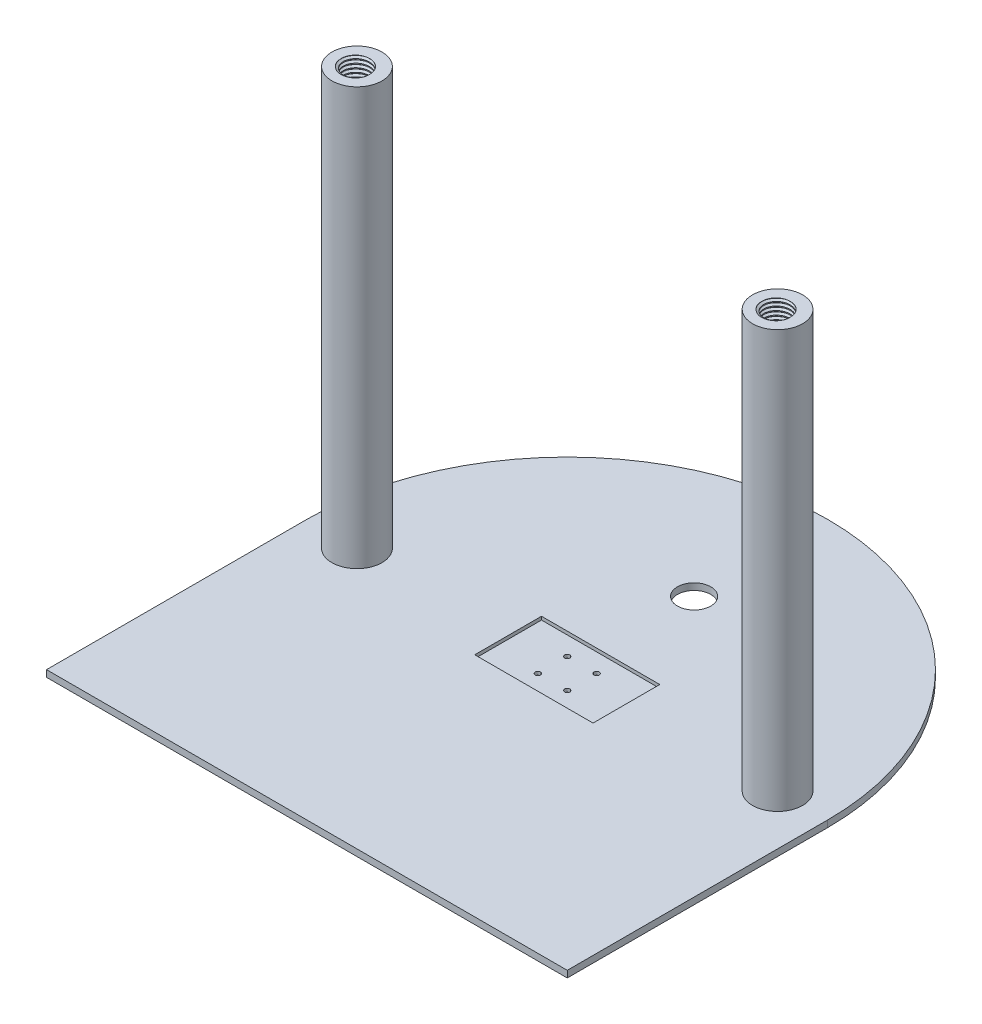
SolidWorks part; units mm, degrees
ref_plane "Front Plane" through (0, 0, 0) normal (0, 0, 1) x (1, 0, 0)
ref_plane "Top Plane" through (0, 0, 0) normal (0, 1, 0) x (1, 0, 0)
ref_plane "Right Plane" through (0, 0, 0) normal (1, 0, 0) x (0, 0, -1)
sketch "Sketch1" plane through (0, 0, 0) normal (0, 1, 0) x (1, 0, 0)
  line L1 (-99.06, 0) -> (99.06, 0)
  line L2 (-99.06, 0) -> (-99.06, -99.06)
  line L3 (-99.06, -99.06) -> (99.06, -99.06)
  line L4 (99.06, 0) -> (99.06, -99.06)
  circle A0 centre (0, 0) radius 99.06
  dimension "D1" = 198.12
extrude "Boss-Extrude1" add sketch "Sketch1" along normal blind 2.54 contours L1 A0 | A0 L1 | A0 L2 L3 | A0 L3 L4
sketch "Sketch2" plane through (0, 2.54, 0) normal (0, 1, 0) x (1, 0, 0)
  line L0 (0, -99.06) -> (0, 99.06) construction
  line L1 (-99.06, -99.06) -> (99.06, -99.06) construction
  line L2 (0, 0) -> (-38.4948, -22.225) construction
  line L3 (0, 0) -> (38.4948, -22.225) construction
  line L4 (0, 0) -> (-80.01, 0) construction
  line L5 (0, 0) -> (80.01, 0) construction
  line L6 (-99.06, 0) -> (-99.06, -99.06) construction
  arc A0 (99.06, 0) -> (-99.06, 0) centre (0, 0) ccw construction
  circle A5 centre (-80.01, 0) radius 6.35
  circle A6 centre (80.01, 0) radius 6.35
  dimension "D7" = 12.7
  dimension "D2" = 120
  dimension "D3" = 120
  dimension "D4" = 44.45
  dimension "D6" = 19.05
extrude "Cut-Extrude1" cut sketch "Sketch2" against normal through all
sketch "Sketch3" plane through (0, 2.54, 0) normal (0, 1, 0) x (1, 0, 0)
  circle A0 centre (-80.01, 0) radius 9.525
  circle A1 centre (80.01, 0) radius 9.525
  circle A2 centre (-80.01, 0) radius 6.35
  circle A3 centre (80.01, 0) radius 6.35
  circle A4 centre (-80.01, 0) radius 6.35 construction
  dimension "D1" = 19.05
extrude "Boss-Extrude2" add sketch "Sketch3" along normal blind 158.75
sketch "Sketch4" plane through (0, 161.29, 0) normal (0, 1, 0) x (1, 0, 0)
  circle A0 centre (-80.01, 0) radius 6.35
  circle A1 centre (80.01, 0) radius 6.35
  circle A2 centre (80.01, 0) radius 6.35 construction
extrude "Boss-Extrude3" add sketch "Sketch4" against normal blind 25.4
sketch "Sketch5" plane through (0, 161.29, 0) normal (0, 1, 0) x (1, 0, 0)
  circle A0 centre (-80.01, 0) radius 5
  circle A1 centre (80.01, 0) radius 5
  dimension "D1" = 10
extrude "Cut-Extrude2" cut sketch "Sketch5" against normal through all
thread "Thread1" pitch 1.5 start angle 0, offset 6.35, length 38.1, pitch 1.5, diameter 10
ref_plane "Plane1" through (-85.01, 167.64, 0) normal (0, 0, 1) x (-1, 0, 0)
sketch "Thread Profile1" plane through (-85.01, 167.64, 0) normal (0, 0, 1) x (-1, 0, 0)
  line L0 (0, 0) -> (0, 1.5) construction
  line L1 (0, 0) -> (0.8119, 0.4687)
  line L2 (0.8119, 0.4687) -> (0.8119, 0.6562)
  line L3 (0.8119, 0.6562) -> (0, 1.125)
  line L4 (0.8119, 0.5625) -> (0, 0.5625) construction
  line L11 (0, 0) -> (0, 1.125)
  point P2 (0, 0)
  dimension "Pitch" = 1.5
  dimension "Profile_Angle" = 60
  dimension "Profile_Land" = 0.1875
  dimension "Profile_Height" = 0.8119
thread "Thread2" pitch 1.5 start angle 0, offset 6.35, length 38.1, pitch 1.5, diameter 10
ref_plane "Plane2" through (75.01, 167.64, 0) normal (0, 0, 1) x (-1, 0, 0)
sketch "Thread Profile2" plane through (75.01, 167.64, 0) normal (0, 0, 1) x (-1, 0, 0)
  line L0 (0, 0) -> (0, 1.5) construction
  line L1 (0, 0) -> (0.8119, 0.4687)
  line L2 (0.8119, 0.4687) -> (0.8119, 0.6562)
  line L3 (0.8119, 0.6562) -> (0, 1.125)
  line L4 (0.8119, 0.5625) -> (0, 0.5625) construction
  line L11 (0, 0) -> (0, 1.125)
  point P2 (0, 0)
  dimension "Pitch" = 1.5
  dimension "Profile_Angle" = 60
  dimension "Profile_Land" = 0.1875
  dimension "Profile_Height" = 0.8119
sketch "Sketch10" plane through (0, 2.54, 0) normal (0, 1, 0) x (1, 0, 0)
  line L0 (0, 0) -> (0, 48.26) construction
  line L1 (0, 48.26) -> (0, 99.06) construction
  arc A0 (99.06, 0) -> (-99.06, 0) centre (0, 0) ccw construction
  circle A1 centre (0, 48.26) radius 6.35
  dimension "D2" = 12.7
  dimension "D1" = 50.8
extrude "Cut-Extrude3" cut sketch "Sketch10" against normal through all
sketch "Sketch13" plane through (0, 2.54, 0) normal (0, 1, 0) x (1, 0, 0)
  line L1 (-22.5, -12.7) -> (22.5, -12.7)
  line L2 (-22.5, -12.7) -> (-22.5, 12.7)
  line L3 (-22.5, 12.7) -> (22.5, 12.7)
  line L4 (22.5, -12.7) -> (22.5, 12.7)
  line L5 (-22.5, -12.7) -> (22.5, 12.7) construction
  line L6 (-22.5, 12.7) -> (22.5, -12.7) construction
  point P0 (0, 0)
  dimension "D1" = 45
  dimension "D2" = 25.4
extrude "Cut-Extrude5" cut sketch "Sketch13" against normal blind 1.27
sketch "Sketch14" plane through (0, 0, 0) normal (0, -1, 0) x (1, 0, 0)
  line L1 (-7.6, -7.6) -> (7.6, -7.6) construction
  line L2 (-7.6, -7.6) -> (-7.6, 7.6) construction
  line L3 (-7.6, 7.6) -> (7.6, 7.6) construction
  line L4 (7.6, -7.6) -> (7.6, 7.6) construction
  line L5 (-7.6, -7.6) -> (7.6, 7.6) construction
  line L6 (-7.6, 7.6) -> (7.6, -7.6) construction
  line L7 (-5.6, -5.6) -> (5.6, -5.6) construction
  line L8 (-5.6, -5.6) -> (-5.6, 5.6) construction
  line L9 (-5.6, 5.6) -> (5.6, 5.6) construction
  line L10 (5.6, -5.6) -> (5.6, 5.6) construction
  line L11 (-5.6, -5.6) -> (5.6, 5.6) construction
  line L12 (-5.6, 5.6) -> (5.6, -5.6) construction
  circle A0 centre (-5.6, -5.6) radius 1
  circle A1 centre (5.6, -5.6) radius 1
  circle A2 centre (5.6, 5.6) radius 1
  circle A3 centre (-5.6, 5.6) radius 1
  point P0 (0, 0)
  point P7 (0, 0)
  dimension "D3" = 2
  dimension "D1" = 15.2
  dimension "D2" = 2
extrude "Cut-Extrude6" cut sketch "Sketch14" against normal through all
